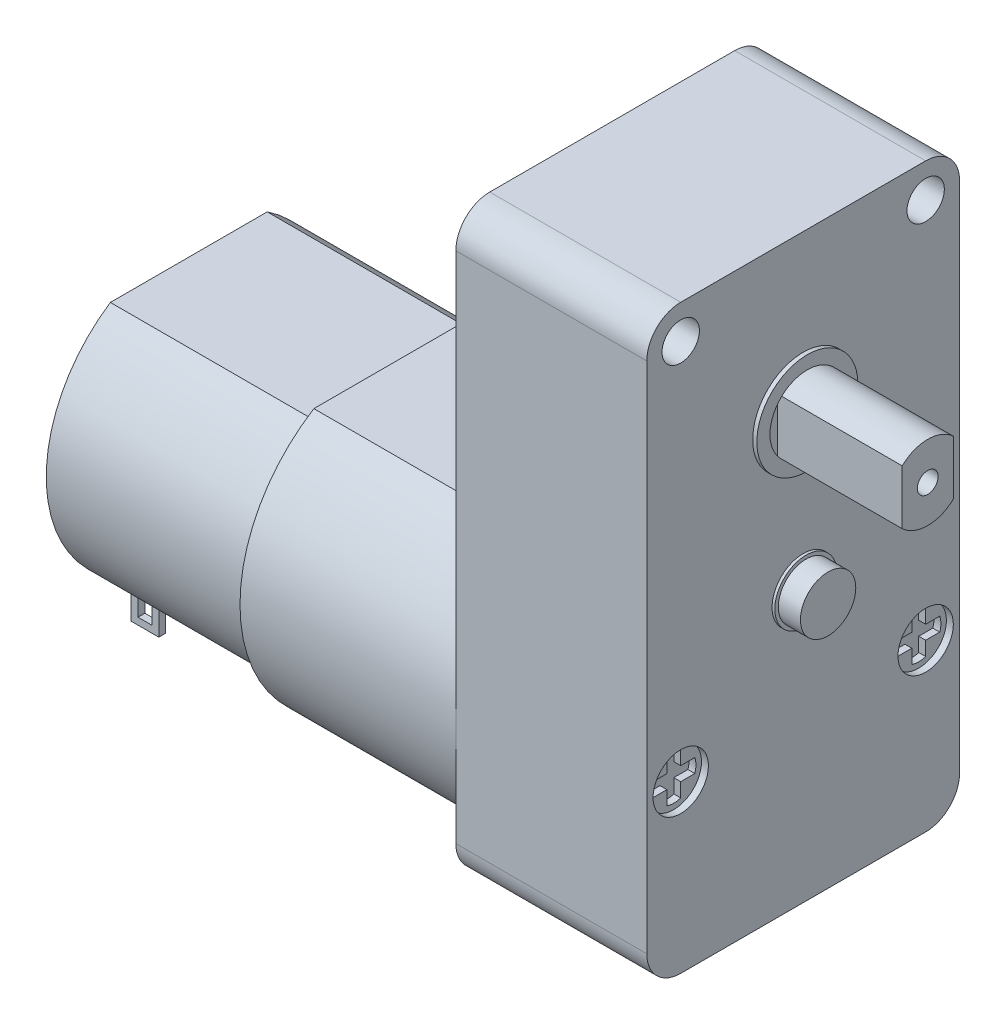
SolidWorks part; units mm, degrees
ref_plane "Front Plane" through (0, 0, 0) normal (0, 0, 1) x (1, 0, 0)
ref_plane "Top Plane" through (0, 0, 0) normal (0, 1, 0) x (1, 0, 0)
ref_plane "Right Plane" through (0, 0, 0) normal (1, 0, 0) x (0, 0, -1)
sketch "Sketch1" plane through (0, 0, 0) normal (1, 0, 0) x (0, 0, -1)
  line L1 (2.45, 0) -> (20.15, 0)
  line L2 (0, 2.45) -> (0, 39.55)
  line L3 (2.45, 42) -> (20.15, 42)
  line L4 (22.6, 2.45) -> (22.6, 39.55)
  arc A0 (0, 2.45) -> (2.45, 0) centre (2.45, 2.45) ccw
  arc A1 (20.15, 0) -> (22.6, 2.45) centre (20.15, 2.45) ccw
  arc A2 (22.6, 39.55) -> (20.15, 42) centre (20.15, 39.55) ccw
  arc A3 (0, 39.55) -> (2.45, 42) centre (2.45, 39.55) cw
  point P7 (0, 0)
  point P10 (22.6, 0)
  point P13 (22.6, 42)
  point P16 (0, 42)
  dimension "D3" = 2.45
  dimension "D1" = 22.6
  dimension "D2" = 42
extrude "Boss-Extrude1" add sketch "Sketch1" along normal blind 13.8
sketch "Sketch2" plane through (13.8, 0, 0) normal (1, 0, 0) x (0, 0, -1)
  line L0 (11.3, 42) -> (11.3, 0) construction
  line L1 (20.15, 42) -> (2.45, 42) construction
  line L2 (2.45, 0) -> (20.15, 0) construction
  circle A0 centre (2.45, 39.55) radius 1.35
  circle A1 centre (20.15, 39.55) radius 1.35
  dimension "D1" = 2.7
  dimension "D2" = 17.7
  dimension "D4" = 2.45
  dimension "D5" = 2.45
  dimension "D3" = 8.85
extrude "Cut-Extrude1" cut sketch "Sketch2" against normal blind 13.8
sketch "Sketch3" plane through (13.8, 0, 0) normal (1, 0, 0) x (0, 0, -1)
  line L0 (11.3, 0) -> (11.3, 42) construction
  line L1 (2.45, 0) -> (20.15, 0) construction
  line L2 (20.15, 42) -> (2.45, 42) construction
  circle A0 centre (11.3, 19.6) radius 2
  dimension "D1" = 4
  dimension "D2" = 19.6
extrude "Boss-Extrude2" add sketch "Sketch3" along normal blind 1.8
sketch "Sketch4" plane through (13.8, 0, 0) normal (1, 0, 0) x (0, 0, -1)
  circle A0 centre (11.3, 19.6) radius 2.25
  dimension "D1" = 4.5
extrude "Boss-Extrude3" add sketch "Sketch4" along normal blind 0.2
sketch "Sketch5" plane through (13.8, 0, 0) normal (1, 0, 0) x (0, 0, -1)
  line L0 (11.3, 42) -> (11.3, 19.6) construction
  line L1 (20.15, 42) -> (2.45, 42) construction
  circle A0 centre (11.3, 30.8) radius 2.7
  circle A1 centre (11.3, 19.6) radius 2 construction
  dimension "D1" = 5.4
  dimension "D2" = 11.2
extrude "Boss-Extrude4" add sketch "Sketch5" along normal blind 9
sketch "Sketch6" plane through (22.8, 0, 0) normal (1, 0, 0) x (0, 0, -1)
  line L0 (11.3, 33.5) -> (11.3, 28.1) construction
  line L2 (9.45, 34.2477) -> (6.3501, 34.2477)
  line L3 (9.45, 34.2477) -> (9.45, 28.1)
  line L4 (9.45, 28.1) -> (6.3501, 28.1)
  line L5 (6.3501, 34.2477) -> (6.3501, 28.1)
  line L6 (13.15, 34.2477) -> (16.2499, 34.2477)
  line L7 (13.15, 34.2477) -> (13.15, 28.1)
  line L8 (13.15, 28.1) -> (16.2499, 28.1)
  line L9 (16.2499, 34.2477) -> (16.2499, 28.1)
  circle A0 centre (11.3, 30.8) radius 2.7 construction
  circle A1 centre (11.3, 30.8) radius 2.7 construction
  dimension "D1" = 3.7
  dimension "D2" = 1.85
extrude "Cut-Extrude2" cut sketch "Sketch6" against normal blind 9
sketch "Sketch7" plane through (22.8, 0, 0) normal (1, 0, 0) x (0, 0, -1)
  circle A0 centre (11.3, 30.8) radius 0.75
  dimension "D1" = 1.5
extrude "Cut-Extrude3" cut sketch "Sketch7" against normal blind 2
sketch "Sketch8" plane through (13.8, 0, 0) normal (1, 0, 0) x (0, 0, -1)
  circle A0 centre (11.3, 30.8) radius 3.65
  circle A1 centre (11.3, 30.8) radius 2.7
  dimension "D1" = 7.3
extrude "Boss-Extrude5" add sketch "Sketch8" along normal blind 0.3
sketch "Sketch9" plane through (13.8, 0, 0) normal (1, 0, 0) x (0, 0, -1)
  line L0 (2.45, 38.2) -> (2.45, 12) construction
  line L1 (20.15, 38.2) -> (20.15, 12) construction
  line L2 (2.45, 0) -> (20.15, 0) construction
  circle A0 centre (2.45, 39.55) radius 1.35 construction
  circle A1 centre (20.15, 39.55) radius 1.35 construction
  circle A2 centre (2.45, 12) radius 2
  circle A3 centre (20.15, 12) radius 2
  dimension "D1" = 4
  dimension "D2" = 12
  dimension "D3" = 12
extrude "Cut-Extrude4" cut sketch "Sketch9" against normal blind 0.5
sketch "Sketch10" plane through (13.3, 0, 0) normal (1, 0, 0) x (0, 0, -1)
  line L0 (11.3, 42) -> (11.3, 0) construction
  line L1 (20.15, 42) -> (2.45, 42) construction
  line L2 (2.45, 0) -> (20.15, 0) construction
  line L3 (2.45, 13.6) -> (2.45, 10.4) construction
  line L4 (0.85, 12) -> (4.05, 12) construction
  line L5 (1.95, 13.5199) -> (1.95, 12.5)
  line L6 (20.65, 13.5199) -> (20.65, 12.5)
  line L7 (2.95, 13.5199) -> (2.95, 12.5)
  line L8 (0.9301, 11.5) -> (1.95, 11.5)
  line L9 (0.9301, 12.5) -> (1.95, 12.5)
  line L10 (2.95, 13.6) -> (2.95, 10.4) construction
  line L11 (0.85, 12.5) -> (4.05, 12.5) construction
  line L12 (0.85, 11.5) -> (4.05, 11.5) construction
  line L13 (1.95, 13.6) -> (1.95, 10.4) construction
  line L14 (2.95, 12.5) -> (3.9699, 12.5)
  line L15 (2.95, 11.5) -> (2.95, 10.4801)
  line L16 (2.95, 11.5) -> (3.9699, 11.5)
  line L17 (1.95, 11.5) -> (1.95, 10.4801)
  line L18 (21.6699, 12.5) -> (20.65, 12.5)
  line L19 (21.6699, 11.5) -> (20.65, 11.5)
  line L20 (20.65, 11.5) -> (20.65, 10.4801)
  line L21 (19.65, 11.5) -> (19.65, 10.4801)
  line L22 (19.65, 11.5) -> (18.6301, 11.5)
  line L23 (19.65, 12.5) -> (18.6301, 12.5)
  line L24 (19.65, 13.5199) -> (19.65, 12.5)
  arc A0 (2.95, 13.5199) -> (1.95, 13.5199) centre (2.45, 12) ccw
  arc A1 (3.9699, 11.5) -> (3.9699, 12.5) centre (2.45, 12) ccw
  arc A2 (1.95, 10.4801) -> (2.95, 10.4801) centre (2.45, 12) ccw
  arc A3 (0.9301, 12.5) -> (0.9301, 11.5) centre (2.45, 12) ccw
  arc A4 (21.6699, 12.5) -> (21.6699, 11.5) centre (20.15, 12) cw
  arc A5 (20.65, 10.4801) -> (19.65, 10.4801) centre (20.15, 12) cw
  arc A6 (18.6301, 11.5) -> (18.6301, 12.5) centre (20.15, 12) cw
  arc A7 (19.65, 13.5199) -> (20.65, 13.5199) centre (20.15, 12) cw
  dimension "D1" = 3.2
  dimension "D2" = 0.5
  dimension "D3" = 0.5
  dimension "D4" = 0.5
  dimension "D5" = 0.5
extrude "Cut-Extrude5" cut sketch "Sketch10" against normal blind 0.5
sketch "Sketch11" plane through (0, 0, 0) normal (-1, 0, 0) x (0, 0, 1)
  line L0 (-17.2607, 0) -> (-5.3393, 0)
  line L1 (-11.3, 42) -> (-11.3, 0) construction
  line L2 (-20.15, 42) -> (-2.45, 42) construction
  line L3 (-2.45, 0) -> (-20.15, 0) construction
  line L4 (-17.2607, 19.2) -> (-5.3393, 19.2)
  line L5 (-22.6, 2.45) -> (-22.6, 39.55) construction
  line L6 (-17.2607, 19.2) -> (-22.6, 19.2) construction
  line L7 (-22.6, 19.2) -> (0, 0) construction
  arc A0 (-17.2607, 19.2) -> (-17.2607, 0) centre (-11.3, 9.6) ccw
  arc A1 (-5.3393, 0) -> (-5.3393, 19.2) centre (-11.3, 9.6) ccw
  point P9 (0, 0)
  dimension "D1" = 19.2
extrude "Boss-Extrude6" add sketch "Sketch11" along normal blind 15.6
sketch "Sketch14" plane through (-15.6, 0, 0) normal (-1, 0, 0) x (0, 0, 1)
  line L2 (-5.3393, 19.2) -> (-17.2607, 19.2) construction
  line L3 (-17.2607, 0) -> (-5.3393, 0) construction
  line L4 (-5.6317, 18.2) -> (-16.9683, 18.2)
  line L5 (-16.9683, 1) -> (-5.6317, 1)
  arc A2 (-17.2607, 19.2) -> (-17.2607, 0) centre (-11.3, 9.6) ccw construction
  arc A3 (-5.3393, 0) -> (-5.3393, 19.2) centre (-11.3, 9.6) ccw construction
  arc A4 (-5.6317, 1) -> (-5.6317, 18.2) centre (-11.3, 9.6) ccw
  arc A5 (-16.9683, 18.2) -> (-16.9683, 1) centre (-11.3, 9.6) ccw
  dimension "D3" = 1
  dimension "D4" = 1
  dimension "D1" = 1
  dimension "D2" = 1
extrude "Boss-Extrude7" add sketch "Sketch14" along normal blind 15
sketch "Sketch15" plane through (-30.6, 0, 0) normal (-1, 0, 0) x (0, 0, 1)
  line L0 (-16.9683, 18.2) -> (-5.6317, 1) construction
  circle A0 centre (-11.3, 9.6) radius 4
  dimension "D1" = 8
extrude "Boss-Extrude8" add sketch "Sketch15" along normal blind 1
sketch "Sketch16" plane through (-31.6, 0, 0) normal (-1, 0, 0) x (0, 0, 1)
  circle A0 centre (-11.3, 9.6) radius 1
  dimension "D1" = 2
extrude "Boss-Extrude9" add sketch "Sketch16" along normal blind 1
sketch "Sketch17" plane through (0, 1, 0) normal (0, -1, 0) x (1, 0, 0)
  line L0 (-30.6, -5.6317) -> (-15.6, -5.6317) construction
  line L1 (-30.1, -6.6317) -> (-28.1, -6.6317)
  line L2 (-30.1, -6.6317) -> (-30.1, -7.1317)
  line L3 (-30.1, -7.1317) -> (-28.1, -7.1317)
  line L4 (-28.1, -6.6317) -> (-28.1, -7.1317)
  line L5 (-30.1, -15.9683) -> (-28.1, -15.9683)
  line L6 (-30.1, -15.9683) -> (-30.1, -15.4683)
  line L7 (-30.1, -15.4683) -> (-28.1, -15.4683)
  line L8 (-28.1, -15.9683) -> (-28.1, -15.4683)
  line L9 (-30.6, -16.9683) -> (-30.6, -5.6317) construction
  line L10 (-30.6, -16.9683) -> (-15.6, -16.9683) construction
  dimension "D1" = 2
  dimension "D2" = 2
  dimension "D3" = 1
  dimension "D4" = 0.5
  dimension "D5" = 0.5
  dimension "D6" = 1
  dimension "D7" = 0.5
  dimension "D8" = 0.5
extrude "Boss-Extrude10" add sketch "Sketch17" along normal blind 3
sketch "Sketch18" plane through (0, 0, -15.9683) normal (0, 0, -1) x (-1, 0, 0)
  line L0 (30.1, -2) -> (28.1, -2) construction
  line L1 (28.6, 0.5) -> (29.6, 0.5)
  line L2 (28.6, 0.5) -> (28.6, -1.5)
  line L3 (28.6, -1.5) -> (29.6, -1.5)
  line L4 (29.6, 0.5) -> (29.6, -1.5)
  line L5 (30.1, -2) -> (30.1, 1) construction
  line L6 (30.1, 1) -> (28.1, 1) construction
  line L7 (28.1, -2) -> (28.1, 1) construction
  dimension "D1" = 0.5
  dimension "D2" = 0.5
  dimension "D3" = 0.5
  dimension "D4" = 0.5
extrude "Cut-Extrude6" cut sketch "Sketch18" against normal blind 13
